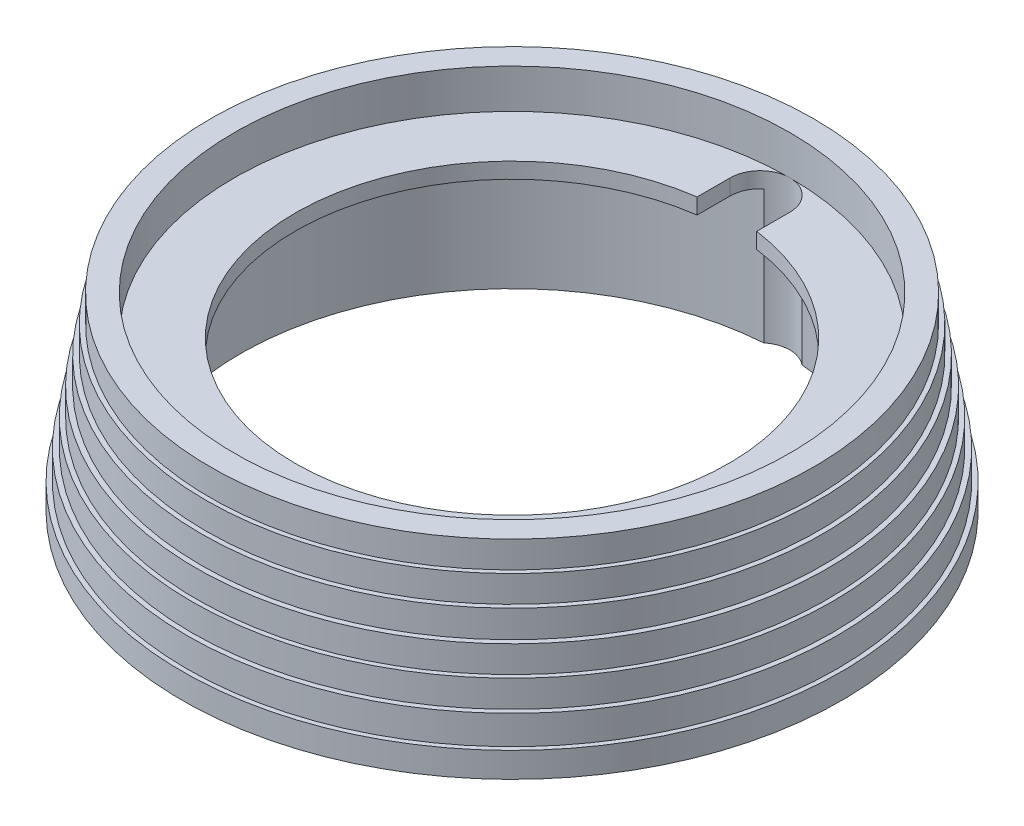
SolidWorks part; units mm, degrees
ref_plane "front" through (0, 0, 0) normal (0, 0, 1) x (1, 0, 0)
ref_plane "top" through (0, 0, 0) normal (0, 1, 0) x (1, 0, 0)
ref_plane "side" through (0, 0, 0) normal (1, 0, 0) x (0, 0, -1)
sketch "Sketch1" plane through (0, 0, 0) normal (0, 0, 1) x (1, 0, 0)
  line L0 (0, 0) -> (0, 63.2231) construction
  line L1 (0, -50) -> (0, 50) construction
  line L2 (0, 0) -> (78.6107, 0) construction
  line L3 (17.5514, 0) -> (17.5514, 12.065)
  line L4 (17.5514, 12.065) -> (22.479, 12.065)
  line L5 (22.479, 12.065) -> (22.479, 15.24)
  line L6 (24.4094, 15.24) -> (22.479, 15.24)
  line L8 (26.67, 0) -> (17.5514, 0)
  line L9 (26.67, 0) -> (26.67, 2.032)
  line L10 (26.67, 2.032) -> (26.3017, 2.032)
  line L11 (26.3017, 2.032) -> (26.3017, 4.3688)
  line L12 (26.3017, 4.3688) -> (25.908, 4.3688)
  line L13 (25.908, 4.3688) -> (25.908, 6.5532)
  line L14 (25.908, 6.5532) -> (25.5524, 6.5532)
  line L15 (25.5524, 6.5532) -> (25.5524, 8.7122)
  line L16 (25.5524, 8.7122) -> (25.146, 8.7122)
  line L17 (25.146, 8.7122) -> (25.146, 10.922)
  line L18 (25.146, 10.922) -> (24.765, 10.922)
  line L19 (24.765, 10.922) -> (24.765, 13.081)
  line L20 (24.765, 13.081) -> (24.4094, 13.081)
  line L21 (24.4094, 13.081) -> (24.4094, 15.24)
  dimension "D1" = 35.1028
  dimension "D2" = 53.34
  dimension "D3" = 44.958
  dimension "D5" = 12.065
  dimension "D7" = 2.032
  dimension "D8" = 4.3688
  dimension "D9" = 6.5532
  dimension "D10" = 8.7122
  dimension "D11" = 10.922
  dimension "D12" = 13.081
  dimension "D13" = 52.6034
  dimension "D14" = 51.816
  dimension "D15" = 51.1048
  dimension "D16" = 50.292
  dimension "D17" = 49.53
  dimension "D18" = 48.8188
revolve "Revolve1" add sketch "Sketch1" angle 360 about L0
sketch "Sketch3" plane through (0, 0, 0) normal (0, -1, 0) x (1, 0, 0)
  circle A0 centre (0, 0) radius 21.971
  dimension "D1" = 43.942
extrude "Cut-Extrude2" cut sketch "Sketch3" against normal blind 10.795
sketch "Sketch4" plane through (0, 12.065, 0) normal (0, 1, 0) x (1, 0, 0)
  line L0 (2.413, 20.066) -> (2.413, 15.2907)
  line L1 (-2.413, 20.066) -> (-2.413, 15.2907)
  line L2 (-2.413, 15.2907) -> (2.413, 15.2907)
  arc A0 (2.413, 20.066) -> (-2.413, 20.066) centre (0, 20.066) ccw
  circle A1 centre (0, 0) radius 22.479 construction
  dimension "D1" = 4.826
extrude "Cut-Extrude3" cut sketch "Sketch4" against normal blind 12.192
